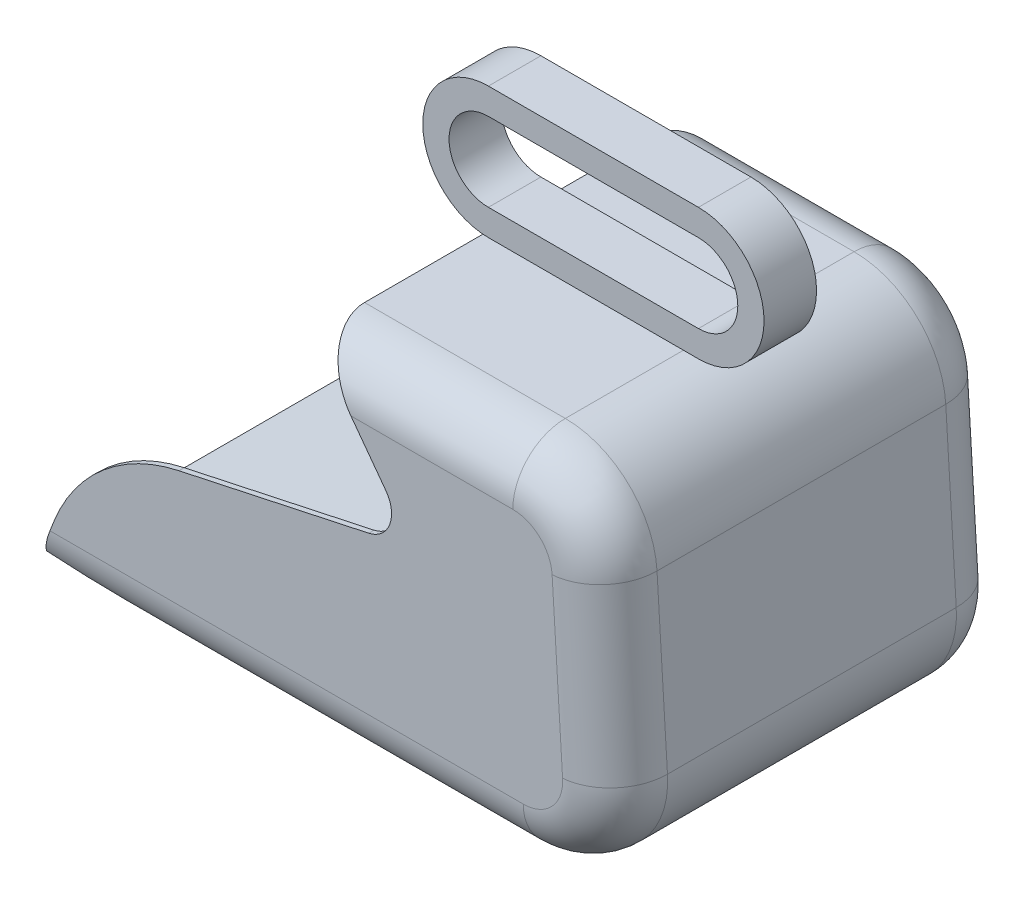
SolidWorks part; units mm, degrees
ref_plane "Front Plane" through (0, 0, 0) normal (0, 0, 1) x (1, 0, 0)
ref_plane "Top Plane" through (0, 0, 0) normal (0, 1, 0) x (1, 0, 0)
ref_plane "Right Plane" through (0, 0, 0) normal (1, 0, 0) x (0, 0, -1)
sketch "Sketch1" plane through (0, 0, 0) normal (0, 0, 1) x (1, 0, 0)
  line L0 (83.3333, 190.5) -> (416.6667, 190.5) construction
  line L1 (25.8911, 44.1344) -> (90.0909, 33.9661)
  line L2 (90.0909, 33.9661) -> (210.0909, 33.9661)
  line L3 (245.0141, 71.2831) -> (241.035, 136.3409)
  line L4 (206.1003, 169.2042) -> (129.6075, 169.2042)
  line L5 (129.6075, 169.2042) -> (157.7513, 131.2042)
  line L8 (31.4021, 58.0853) -> (25.8911, 44.1344)
  line L9 (151.2229, 113.9029) -> (78.9185, 98.3636)
  line L10 (245.0141, 71.2831) -> (234.5593, 228.8667) construction
  arc A0 (210.0909, 33.9661) -> (245.0141, 71.2831) centre (210.0909, 68.9661) ccw
  arc A1 (241.035, 136.3409) -> (206.1003, 169.2042) centre (206.1003, 134.2042) ccw
  arc A2 (151.2229, 113.9029) -> (157.7513, 131.2042) centre (148.9116, 124.6573) ccw
  arc A3 (78.9185, 98.3636) -> (31.4021, 58.0853) centre (92.7863, 33.8369) ccw
  dimension "D2" = 35
  dimension "D3" = 35
  dimension "D9" = 11
  dimension "D10" = 66
  dimension "D7" = 3.5
  dimension "D4" = 120
  dimension "D5" = 65
  dimension "D6" = 9
  dimension "D8" = 38
  dimension "D11" = 15
extrude "Boss-Extrude1" add sketch "Sketch1" along normal mid plane 150
shell "Shell1" thickness 2
fillet "Fillet2" radius 20 20 edges at (241.0284, 103.6873, 73) (228.7113, 158.2404, 73) (168.5945, 167.2042, 73) (150.0909, 33.9661, 75) (235.6456, 45.0506, 75) (243.0245, 103.812, 75) (230.0817, 159.6972, 75) (234.1871, 46.4191, -73) (241.0284, 103.6873, -73) (168.5945, 167.2042, -73) (150.0909, 33.9661, -75) (167.8539, 169.2042, -75) (230.0817, 159.6972, -75) (167.8539, 169.2042, 75) (150.1696, 35.9661, 73) (234.1871, 46.4191, 73) (150.1696, 35.9661, -73) (235.6456, 45.0506, -75) (228.7113, 158.2404, -73) (243.0245, 103.812, -75)
sketch "Sketch2" plane through (0, 0, 0) normal (0, 0, 1) x (1, 0, 0)
  line L0 (131.804, 194.2042) -> (211.804, 194.2042) construction
  line L1 (131.804, 219.2042) -> (211.804, 219.2042)
  line L2 (131.804, 169.2042) -> (211.804, 169.2042)
  line L3 (131.804, 209.2042) -> (211.804, 209.2042)
  line L4 (131.804, 179.2042) -> (211.804, 179.2042)
  line L5 (245.0141, 71.2831) -> (234.5593, 228.8667) construction
  line L7 (206.1003, 169.2042) -> (129.6075, 169.2042) construction
  arc A0 (131.804, 219.2042) -> (131.804, 169.2042) centre (131.804, 194.2042) ccw
  arc A1 (211.804, 169.2042) -> (211.804, 219.2042) centre (211.804, 194.2042) ccw
  arc A2 (211.804, 179.2042) -> (211.804, 209.2042) centre (211.804, 194.2042) ccw
  arc A3 (131.804, 209.2042) -> (131.804, 179.2042) centre (131.804, 194.2042) ccw
  point P2 (171.804, 194.2042)
  point P13 (0, 0)
  point P14 (161.3725, 206.4342)
  point P19 (162.5902, 203.7492)
  dimension "D3" = 25
  dimension "D1" = 10
  dimension "D2" = 80
extrude "Boss-Extrude2" add sketch "Sketch2" along normal mid plane 20 separate body
